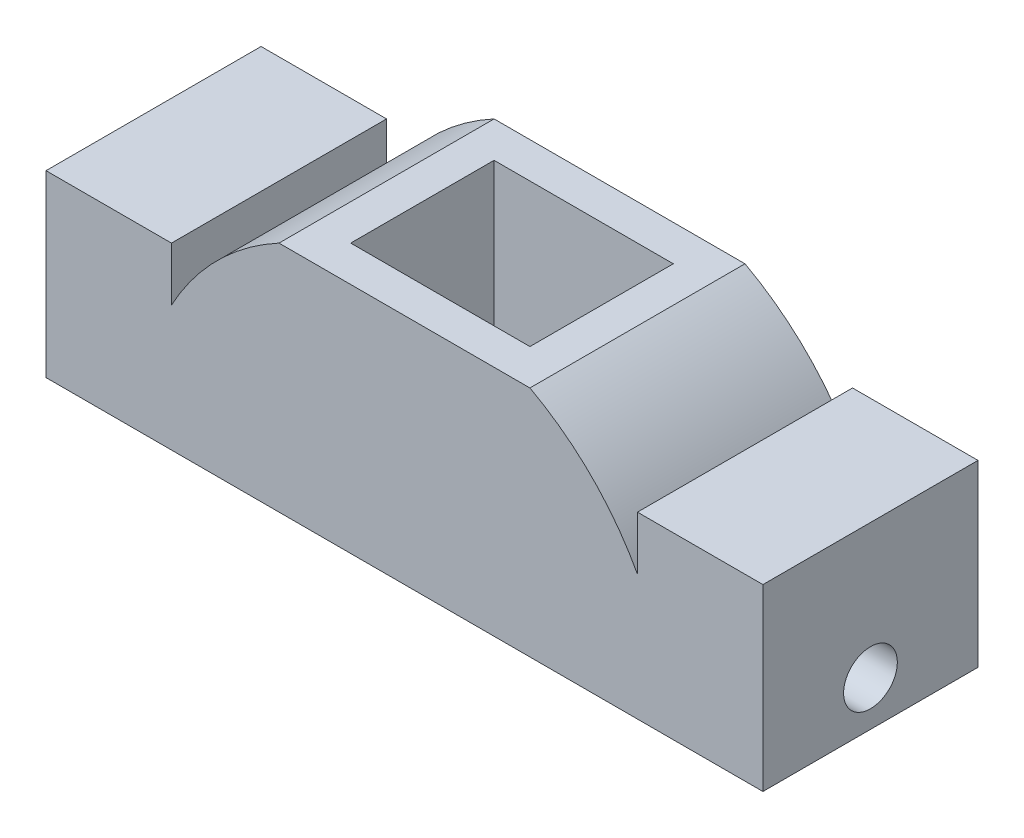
SolidWorks part; units mm, degrees
ref_plane "Front Plane" through (0, 0, 0) normal (0, 0, 1) x (1, 0, 0)
ref_plane "Top Plane" through (0, 0, 0) normal (0, 1, 0) x (1, 0, 0)
ref_plane "Right Plane" through (0, 0, 0) normal (1, 0, 0) x (0, 0, -1)
sketch "Sketch1" plane through (0, 0, 0) normal (0, 0, 1) x (1, 0, 0)
  line L0 (-65, 50) -> (-65, 35)
  line L1 (-100, 50) -> (-65, 50)
  line L2 (-100, 50) -> (-100, 0)
  line L3 (100, 50) -> (100, 0)
  line L4 (100, 50) -> (65, 50)
  line L5 (65, 50) -> (65, 35)
  line L6 (0, 0) -> (0, 50) construction
  line L7 (-35, 65) -> (35, 65)
  line L8 (-100, 0) -> (100, 0)
  line L10 (0, 0) -> (-100, 0) construction
  arc A0 (35, 65) -> (65, 35) centre (0, 0) cw
  arc A1 (-35, 65) -> (-65, 35) centre (0, 0) ccw
  point P10 (0, 65)
  dimension "D1" = 100
  dimension "D2" = 50
  dimension "D3" = 15
  dimension "D4" = 35
  dimension "D5" = 35
extrude "Extrude1" add sketch "Sketch1" along normal blind 60
sketch "Sketch2" plane through (0, 65, 0) normal (0, 1, 0) x (-1, 0, 0)
  line L8 (-25, 10) -> (25, 10)
  line L9 (25, 10) -> (25, 50)
  line L10 (25, 50) -> (-25, 50)
  line L11 (-25, 50) -> (-25, 10)
  line L12 (-25, 10) -> (25, 10)
  line L13 (25, 10) -> (25, 50)
  line L14 (25, 50) -> (-25, 50)
  line L15 (-25, 50) -> (-25, 10)
  dimension "D1" = 10
extrude "Cut-Extrude1" cut sketch "Sketch2" against normal blind 60
sketch "Sketch3" plane through (100, 0, 0) normal (1, 0, 0) x (0, 0, -1)
  line L0 (-60, 25) -> (0, 25) construction
  line L3 (-60, 0) -> (-60, 50) construction
  line L4 (0, 0) -> (0, 50) construction
  line L5 (-30, 25) -> (-30, 0) construction
  line L6 (-60, 0) -> (0, 0) construction
  circle A0 centre (-30, 12.5) radius 7.5
  dimension "D1" = 15
extrude "Cut-Extrude2" cut sketch "Sketch3" against normal through all
